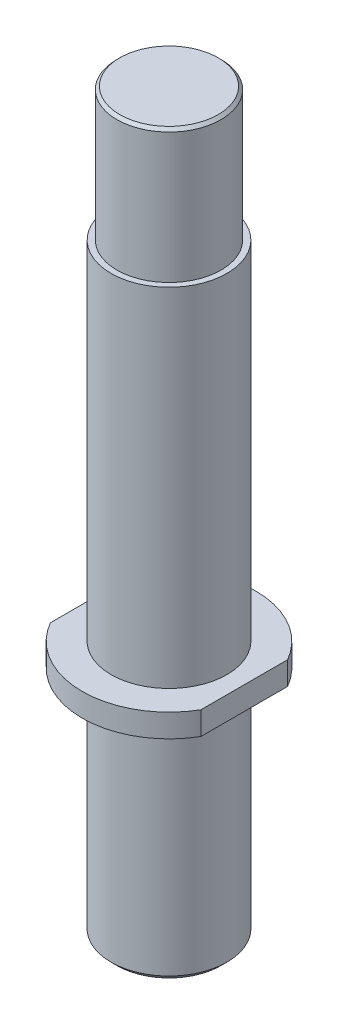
SolidWorks part; units mm, degrees
ref_plane "Alzado" through (0, 0, 0) normal (0, 0, 1) x (1, 0, 0)
ref_plane "Planta" through (0, 0, 0) normal (0, 1, 0) x (1, 0, 0)
ref_plane "Vista lateral" through (0, 0, 0) normal (1, 0, 0) x (0, 0, -1)
sketch "Croquis1" plane through (0, 0, 0) normal (0, 1, 0) x (1, 0, 0)
  circle A0 centre (0, 0) radius 10
  dimension "D1" = 20
extrude "Saliente-Extruir1" add sketch "Croquis1" along normal blind 40
sketch "Croquis2" plane through (0, 40, 0) normal (0, 1, 0) x (1, 0, 0)
  circle A0 centre (0, 0) radius 15
  dimension "D1" = 30
extrude "Saliente-Extruir2" add sketch "Croquis2" along normal blind 4
sketch "Croquis3" plane through (0, 44, 0) normal (0, 1, 0) x (1, 0, 0)
  line L0 (13, 20.9321) -> (28.4845, -2.7221)
  line L1 (-13, 20.9321) -> (-13, -24.0296)
  line L2 (13, 20.9321) -> (13, -24.0296)
  line L3 (28.4845, -2.7221) -> (13, -24.0296)
  line L4 (-13, 20.9321) -> (-34.4919, -2.7221)
  line L5 (-34.4919, -2.7221) -> (-13, -24.0296)
  dimension "D1" = 13
  dimension "D2" = 13
extrude "Cortar-Extruir1" cut sketch "Croquis3" against normal blind 4
chamfer "Chaflán1" distance 1 angle 45 1 edges at (0, 0, 10)
sketch "Croquis4" plane through (0, 0, 0) normal (0, -1, 0) x (1, 0, 0)
  circle A0 centre (0, 0) radius 5
  dimension "D1" = 10
extrude "Cortar-Extruir2" cut sketch "Croquis4" against normal blind 34
chamfer "Chaflán2" distance 0.5 angle 45 1 edges at (0, 0, -5)
sketch "Croquis5" plane through (0, 34, 0) normal (0, -1, 0) x (1, 0, 0)
  circle A1 centre (0, 0) radius 5
  circle A2 centre (0, 0) radius 5
  dimension "D1" = 0
extrude "Cortar-Extruir3" cut sketch "Croquis5" against normal blind 2 draft 73
sketch "Croquis6" plane through (0, 44, 0) normal (0, 1, 0) x (1, 0, 0)
  circle A0 centre (0, 0) radius 10
  dimension "D1" = 20
extrude "Saliente-Extruir3" add sketch "Croquis6" along normal blind 60
sketch "Croquis7" plane through (0, 104, 0) normal (0, 1, 0) x (1, 0, 0)
  circle A0 centre (0, 0) radius 9
  dimension "D1" = 18
extrude "Saliente-Extruir4" add sketch "Croquis7" along normal blind 23
chamfer "Chaflán3" distance 0.5 angle 45 1 edges at (0, 127, 9)
